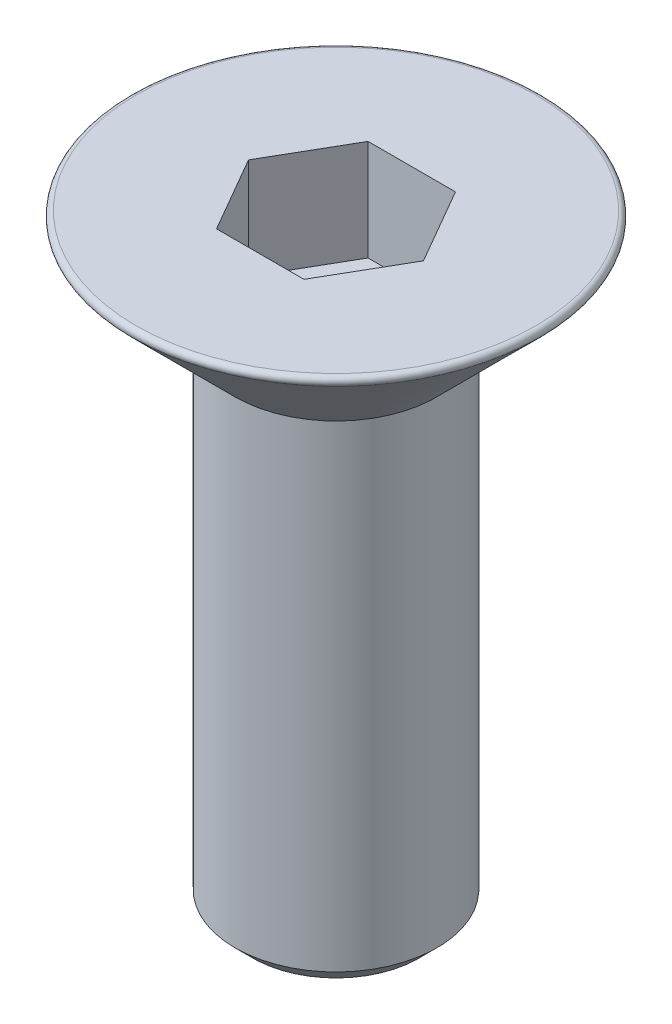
SolidWorks part; units mm, degrees
ref_plane "Plan1" through (0, 0, 0) normal (0, 0, 1) x (1, 0, 0)
ref_plane "Plan2" through (0, 0, 0) normal (0, 1, 0) x (1, 0, 0)
ref_plane "Plan3" through (0, 0, 0) normal (1, 0, 0) x (0, 0, -1)
sketch "Esquisse1" plane through (0, 0, 0) normal (0, 0, 1) x (1, 0, 0)
  line L0 (0, 7.3507) -> (0, -15.1588) construction
  line L1 (0, 0) -> (4.2, 0)
  line L2 (4.2, 0) -> (2, -2.2)
  line L3 (2, -2.2) -> (2, -12)
  line L4 (2, -12) -> (0, -12)
  line L5 (0, -12) -> (0, 0)
  dimension "D1" = 45
  dimension "D2" = 4
  dimension "D3" = 8.4
  dimension "D4" = 12
revolve "Base-Révolution" add sketch "Esquisse1" angle 360 about L0
sketch "Esquisse2" plane through (-0.4184, 0, 2.0942) normal (0, 1, 0) x (-1, 0, 0)
  line L0 (-0.4184, 0.1336) -> (-0.4184, -9.7892) construction
  line L1 (-2.9949, -2.0942) -> (7.5971, -2.0942) construction
  line L2 (0.4476, -0.5942) -> (1.3136, -2.0942)
  line L3 (0.4476, -0.5942) -> (-1.2844, -0.5942)
  line L4 (-1.2844, -0.5942) -> (-2.1505, -2.0942)
  line L5 (0.4476, -3.5942) -> (1.3136, -2.0942)
  line L6 (-1.2844, -3.5942) -> (-2.1505, -2.0942)
  line L7 (0.4476, -3.5942) -> (-1.2844, -3.5942)
  circle A0 centre (-0.4184, -2.0942) radius 1.7321 construction
  point P13 (-0.4184, -0.5942)
  dimension "D1" = 3
extrude "Enlèv. mat.-Extru.1" cut sketch "Esquisse2" against normal blind 2
chamfer "Chanfrein1" distance 0.35 angle 45 1 edges at (0, -12, 2)
fillet "Congé1" radius 0.1 1 edges at (0, 0, 4.2)
